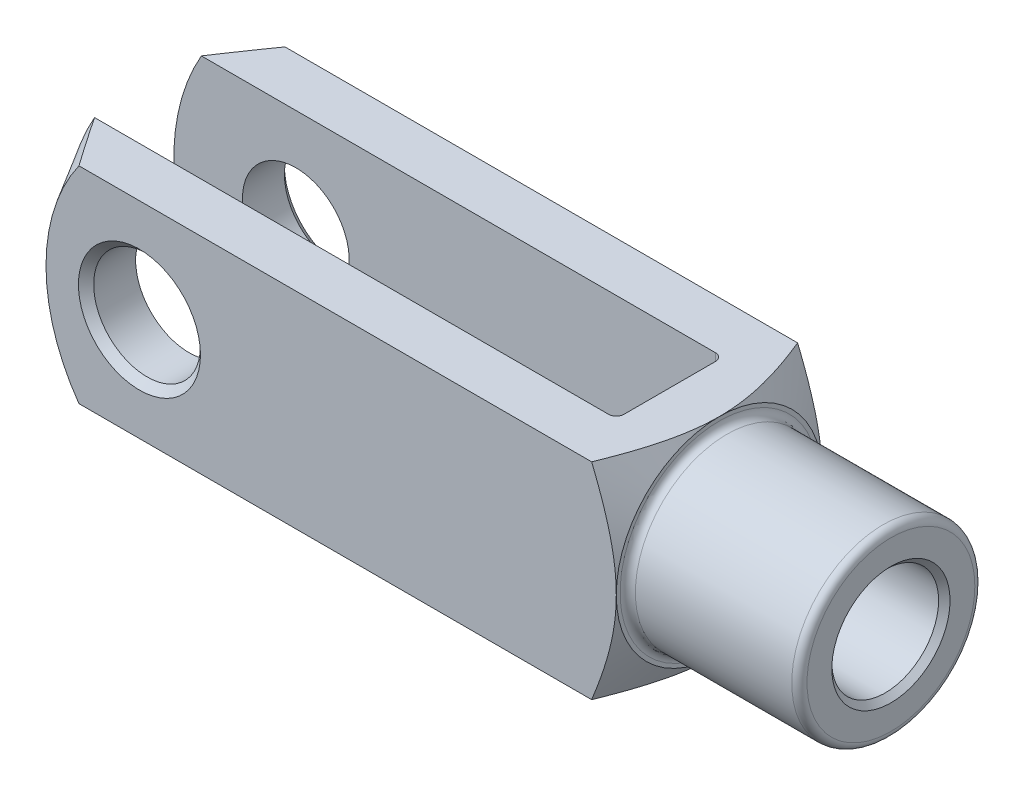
SolidWorks part; units mm, degrees
ref_plane "Front Plane" through (0, 0, 0) normal (0, 0, 1) x (1, 0, 0)
ref_plane "Top Plane" through (0, 0, 0) normal (0, 1, 0) x (1, 0, 0)
ref_plane "Right Plane" through (0, 0, 0) normal (1, 0, 0) x (0, 0, -1)
sketch "Sketch1" plane through (0, 0, 0) normal (1, 0, 0) x (0, 0, -1)
  line L0 (0, 0) -> (0, 50000) construction
  line L1 (0, 0) -> (50000, 0) construction
  line L2 (-13.5, -13.5) -> (-13.5, 13.5)
  line L3 (-13.5, 13.5) -> (13.5, 13.5)
  line L4 (13.5, -13.5) -> (13.5, 13.5)
  line L5 (-13.5, -13.5) -> (13.5, -13.5)
  point P9 (0, 13.5)
  point P11 (13.5, 0)
  point P12 (-13.5, 0)
  dimension "D1" = 27
  dimension "D2" = 27
extrude "Extrude1" add sketch "Sketch1" against normal blind 101
sketch "Sketch2" plane through (0, 0, 0) normal (1, 0, 0) x (0, 0, -1)
  circle A0 centre (0, 0) radius 12
  circle A1 centre (0, 0) radius 24
  dimension "D1" = 24
  dimension "D2" = 48
extrude "Extrude2" cut sketch "Sketch2" against normal blind 22.5
sketch "Sketch3" plane through (0, 0, 13.5) normal (0, 0, 1) x (1, 0, 0)
  circle A0 centre (-85, 0) radius 7
  dimension "D1" = 14
  dimension "D2" = 85
extrude "Extrude3" cut sketch "Sketch3" against normal through all
sketch "Sketch4" plane through (0, 13.5, 0) normal (0, 1, 0) x (1, 0, 0)
  line L0 (0, 0) -> (-50000, 0) construction
  line L1 (-101, -7) -> (-101, 7)
  line L2 (-101, 13.5) -> (-101, -13.5) construction
  line L3 (-101, 7) -> (-29, 7)
  line L4 (-29, 7) -> (-29, -7)
  line L5 (-85, 13.5) -> (-85, -13.5) construction
  line L6 (-101, -7) -> (-29, -7)
  point P7 (-85, 0)
  point P13 (-29, 0)
  point P14 (-101, 0)
  dimension "D1" = 56
  dimension "D2" = 14
extrude "Extrude4" cut sketch "Sketch4" against normal through all
fillet "Fillet1" radius 1 2 edges at (-29, 0, 7) (-29, 0, -7)
fillet "Fillet2" radius 1 2 edges at (0, 0, -12) (-22.5, 0, -12)
chamfer "Chamfer2" distance 1 angle 45 2 edges at (-78, 0, -13.5) (-78, 0, 13.5)
sketch "Sketch6" plane through (0, 0, 0) normal (0, 0, 1) x (1, 0, 0)
  line L0 (-22.5, -13.5) -> (-22.5, -27)
  line L1 (-22.5, -27) -> (-30.2942, -27)
  line L2 (-30.2942, -27) -> (-22.5, -13.5)
  dimension "D1" = 30
  dimension "D2" = 27
revolve "Cut-Revolve1" cut sketch "Sketch6" angle 360 about axis through (-22.5, 0, 0) along (1, 0, 0)
sketch "Sketch7" plane through (0, 0, 0) normal (0, 1, 0) x (1, 0, 0)
  line L0 (-97.2472, -13.5) -> (-101, -7)
  line L1 (-101, 7) -> (-97.2472, 13.5)
  line L2 (-97.2472, 13.5) -> (-128, 13.5)
  line L3 (-101, 7) -> (-101, -7)
  line L4 (-128, 13.5) -> (-128, -13.5)
  line L5 (-128, -13.5) -> (-97.2472, -13.5)
  line L6 (-101, 13.5) -> (-25.7285, 13.5) construction
  line L7 (-101, -13.5) -> (-25.7285, -13.5) construction
  line L8 (-74, 0.6162) -> (-74, 50000.6162) construction
  dimension "D1" = 120
  dimension "D2" = 27
  dimension "D3" = 27
revolve "Cut-Revolve2" cut sketch "Sketch7" angle 180 about L8
sketch "Sketch8" plane through (0, 0, 0) normal (1, 0, 0) x (0, 0, -1)
  circle A0 centre (0, 0) radius 7
  dimension "D1" = 14
extrude "Extrude5" cut sketch "Sketch8" against normal through all
chamfer "Chamfer3" distance 0.75 angle 45 1 edges at (0, 0, -7)
equation "\"D2@Sketch1\" = \"D1@Sketch1\""
equation "\"D2@Sketch2\" = \"D1@Sketch2\"*2"
equation "\"D2@Sketch6\" = \"D1@Sketch1\""
equation "\"D2@Sketch7\" = \"D1@Sketch1\""
equation "\"D3@Sketch7\" = \"D1@Sketch1\""
